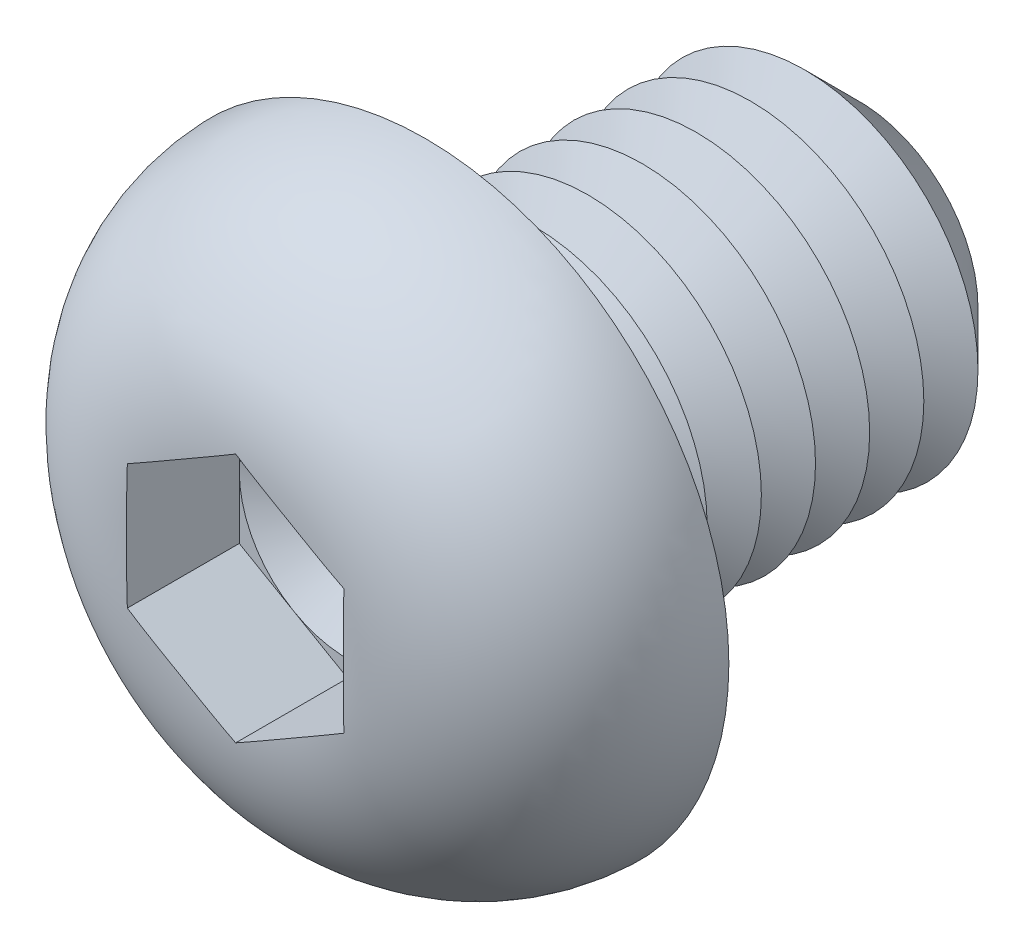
SolidWorks part; units mm, degrees
ref_plane "Front Plane" through (0, 0, 0) normal (0, 0, 1) x (1, 0, 0)
ref_plane "Top Plane" through (0, 0, 0) normal (0, 1, 0) x (1, 0, 0)
ref_plane "Right Plane" through (0, 0, 0) normal (1, 0, 0) x (0, 0, -1)
sketch "Sketch1" plane through (0, 0, 0) normal (1, 0, 0) x (0, 0, -1)
  line L0 (-47.9342, 0) -> (60.3146, 0) construction
sketch "Sketch2" plane through (0, 0, 0) normal (1, 0, 0) x (0, 0, -1)
  line L0 (0, 0) -> (-4.4, 0)
  line L1 (-47.9342, 0) -> (60.3146, 0) construction
  line L2 (-4.4, 0) -> (-4.4, 2.5011)
  line L3 (0, 7) -> (0, 0)
  arc A0 (-4.4, 2.5011) -> (0, 7) centre (0.1, 2.5011) cw
  dimension "D1" = 4.5
  dimension "D2" = 4.4
  dimension "D3" = 7
revolve "Revolve1" add sketch "Sketch2" angle 360 about L0
sketch "Sketch3" plane through (0, 0, 4.4) normal (0, 0, 1) x (1, 0, 0)
  line L1 (0, 2.8868) -> (-2.5, 1.4434)
  line L2 (-2.5, 1.4434) -> (-2.5, -1.4434)
  line L3 (-2.5, -1.4434) -> (0, -2.8868)
  line L4 (0, -2.8868) -> (2.5, -1.4434)
  line L5 (2.5, -1.4434) -> (2.5, 1.4434)
  line L6 (2.5, 1.4434) -> (0, 2.8868)
  circle A0 centre (0, 0) radius 2.5 construction
  dimension "D1" = 5
extrude "Cut-Extrude1" cut sketch "Sketch3" against normal blind 2.6
sketch "Sketch4" plane through (0, 0, 0) normal (0, 0, -1) x (-1, 0, 0)
  circle A0 centre (0, 0) radius 4
  dimension "D1" = 8
extrude "Boss-Extrude1" add sketch "Sketch4" along normal blind 10
chamfer "Chamfer1" distance 1.25 angle 45 1 edges at (-4, 0, -10)
sketch "Sketch5" plane through (0, 0, 0) normal (1, 0, 0) x (0, 0, -1)
  line L0 (1.25, 4) -> (2.5, 4)
  line L1 (8.75, 4) -> (0, 4) construction
  line L2 (2.5, 4) -> (1.875, 2.9175)
  line L3 (1.875, 2.9175) -> (1.25, 4)
  line L4 (0, -7) -> (0, 7) construction
  line L5 (8.75, 4) -> (0, 4) construction
  dimension "D1" = 1.25
  dimension "D2" = 1.25
revolve "Cut-Revolve1" cut sketch "Sketch5" angle 360 about L0
pattern_linear "LPattern1" count 6 spacing 1.25 along (0, 0, -1) of "Cut-Revolve1"
fillet "Fillet2" radius 0.5 1 edges at (4, 0, 0)
sketch "Sketch6" plane through (0, 0, 1.8) normal (0, 0, 1) x (1, 0, 0)
  line L0 (0, -2.8868) -> (2.5, -1.4434) construction
  circle A0 centre (0, 0) radius 2.5
extrude "Cut-Extrude2" cut sketch "Sketch6" against normal through all draft 60
